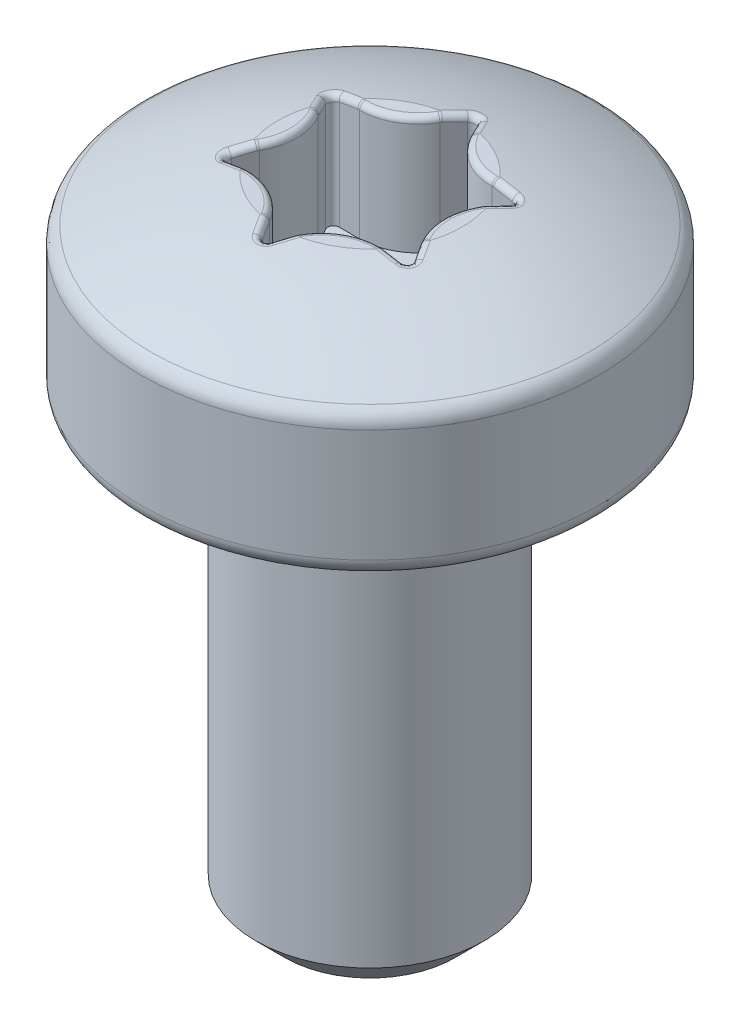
SolidWorks part; units mm, degrees
ref_plane "Plan de face" through (0, 0, 0) normal (0, 0, 1) x (1, 0, 0)
ref_plane "Plan de dessus" through (0, 0, 0) normal (0, 1, 0) x (1, 0, 0)
ref_plane "Plan de droite" through (0, 0, 0) normal (1, 0, 0) x (0, 0, -1)
sketch "Esquisse1" plane through (0, 0, 0) normal (0, 0, 1) x (1, 0, 0)
  line L0 (0, 0) -> (0, 27.1265) construction
  line L1 (0, 0) -> (1.95, 0)
  line L2 (1.95, 0) -> (1.95, 7.6)
  line L3 (1.95, 7.6) -> (3.6, 7.6)
  line L4 (3.9, 7.9) -> (3.9, 9.8202)
  line L5 (0, 11) -> (0, 0)
  arc A0 (3.7384, 10.0864) -> (0, 11) centre (0, 2.895) ccw
  arc A1 (3.6, 7.6) -> (3.9, 7.9) centre (3.6, 7.9) ccw
  arc A2 (3.9, 9.8202) -> (3.7384, 10.0864) centre (3.6, 9.8202) ccw
  point P11 (3.9, 7.6)
  point P14 (3.9, 10)
  dimension "D6" = 0.3
  dimension "D1" = 3.9
  dimension "D2" = 7.8
  dimension "D3" = 11
  dimension "D4" = 2.4
  dimension "D5" = 3.4
revolve "Révolution1" add sketch "Esquisse1" angle 360 about L5
sketch "Esquisse2" plane through (0, 0, 0) normal (0, 0, 1) x (1, 0, 0)
  line L0 (0, 11.2237) -> (0, 8.9518) construction
  line L1 (0, 12) -> (0, 9)
  line L2 (0, 9) -> (1, 9.5774)
  line L3 (1, 9.5774) -> (1, 10.8463)
  line L4 (1, 12) -> (0, 12)
  line L5 (1, 11.5624) -> (1, 12)
  line L6 (1, 11.5624) -> (1.5709, 11.5624)
  line L8 (1, 10.8463) -> (1.5709, 10.8463)
  line L9 (1.5709, 11.5624) -> (1.5709, 10.8463)
  arc A0 (3.7384, 10.0864) -> (-3.7384, 10.0864) centre (0, 2.895) ccw construction
  point P5 (0, 11)
  dimension "D1" = 1
  dimension "D2" = 60
  dimension "D3" = 2
  dimension "D4" = 3
  dimension "D5" = 90
  dimension "D6" = 1.5709
  dimension "D7" = 0.7161
revolve "Enlèvement de matière-Révolution1" cut sketch "Esquisse2" angle 360 about L1
sketch "Esquisse3" plane through (0, 10.8463, 0) normal (0, 1, 0) x (-1, 0, 0)
  line L2 (0.2598, 1.45) -> (0.0866, 1.75)
  line L3 (-0.0866, 1.75) -> (-0.2598, 1.45)
  line L4 (-1.4722, -0.95) -> (-1.1258, -0.95)
  line L5 (1.5588, -0.8) -> (1.3856, -0.5)
  line L6 (1.4722, 0.95) -> (1.1258, 0.95)
  line L7 (-1.5588, 0.8) -> (-1.3856, 0.5)
  line L8 (0.0866, -1.75) -> (0.2598, -1.45)
  line L9 (-1.1258, 0.95) -> (-1.4722, 0.95)
  line L10 (-1.3856, -0.5) -> (-1.5588, -0.8)
  line L11 (-0.2598, -1.45) -> (-0.0866, -1.75)
  line L12 (1.1258, -0.95) -> (1.4722, -0.95)
  line L13 (1.3856, 0.5) -> (1.5588, 0.8)
  arc A1 (-1.1258, 0.95) -> (-0.2598, 1.45) centre (-1.1258, 1.95) ccw
  arc A2 (-1.3856, -0.5) -> (-1.3856, 0.5) centre (-2.2517, 0) ccw
  arc A3 (-0.2598, -1.45) -> (-1.1258, -0.95) centre (-1.1258, -1.95) ccw
  arc A4 (1.1258, -0.95) -> (0.2598, -1.45) centre (1.1258, -1.95) ccw
  arc A5 (1.3856, 0.5) -> (1.3856, -0.5) centre (2.2517, 0) ccw
  arc A6 (0.2598, 1.45) -> (1.1258, 0.95) centre (1.1258, 1.95) ccw
  arc A7 (1.5588, 0.8) -> (1.4722, 0.95) centre (1.4722, 0.85) ccw
  arc A8 (-0.0866, 1.75) -> (0.0866, 1.75) centre (0, 1.7) cw
  arc A9 (-1.5588, 0.8) -> (-1.4722, 0.95) centre (-1.4722, 0.85) cw
  arc A10 (-1.4722, -0.95) -> (-1.5588, -0.8) centre (-1.4722, -0.85) cw
  arc A11 (0.0866, -1.75) -> (-0.0866, -1.75) centre (0, -1.7) cw
  arc A12 (1.5588, -0.8) -> (1.4722, -0.95) centre (1.4722, -0.85) cw
  point P0 (0, 1.9)
  point P3 (1.6454, 0.95)
  point P30 (1.6454, 0.95)
  point P33 (0, 1.9)
  dimension "D2" = 1
  dimension "D3" = 0.1
  dimension "D1" = 1.9
extrude "Enlèv. mat.-Extru.1" cut sketch "Esquisse3" against normal blind 2
fillet "Congé1" radius 0.1 36 edges at (-1.1885, 10.8463, 0.95) (-0.2285, 10.8463, 1.5043) (-0.6258, 10.8463, 1.084) (-1.417, 10.8463, -0.5543) (-1.417, 10.8463, 0.5543) (-0.2285, 10.8463, -1.5043) (-1.1885, 10.8463, -0.95) (1.1885, 10.8463, -0.95) (0.2285, 10.8463, -1.5043) (1.417, 10.8463, 0.5543) (1.417, 10.8463, -0.5543) (1.5036, 10.8281, 0.7044) (1.3618, 10.8281, 0.95) (0.2285, 10.8463, 1.5043) (1.1885, 10.8463, 0.95) (1.3618, 10.8281, -0.95) (1.5036, 10.8281, -0.7044) (-0.1418, 10.8281, -1.6544) (0.1418, 10.8281, -1.6544) (-1.5036, 10.8281, -0.7044) (-1.3618, 10.8281, -0.95) (-1.3618, 10.8281, 0.95) (-1.5036, 10.8281, 0.7044) (0.1418, 10.8281, 1.6544) (-0.1418, 10.8281, 1.6544) (-1.2517, 10.8463, 0) (-0.6258, 10.8463, -1.084) (0.6258, 10.8463, -1.084) (1.2517, 10.8463, 0) (1.5606, 10.7976, 0.8968) (0.6258, 10.8463, 1.084) (1.5569, 10.7976, -0.9032) (-0.0037, 10.7976, -1.7999) (-1.5606, 10.7976, -0.8968) (-1.5569, 10.7976, 0.9032) (0.0037, 10.7976, 1.7999)
chamfer "Chanfrein1" distance 0.5 angle 45 1 edges at (0, 0, 1.95)
